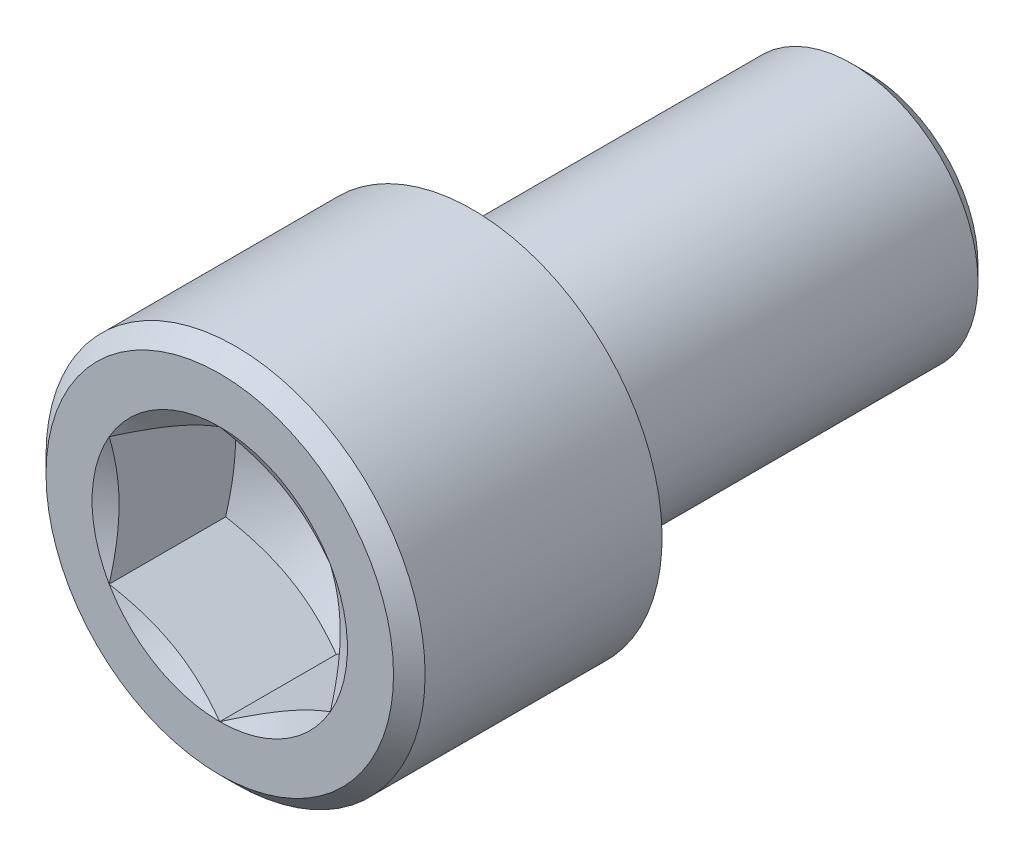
SolidWorks part; units mm, degrees
ref_plane "Front" through (0, 0, 0) normal (0, 0, 1) x (1, 0, 0)
ref_plane "Top" through (0, 0, 0) normal (0, 1, 0) x (1, 0, 0)
ref_plane "Right" through (0, 0, 0) normal (1, 0, 0) x (0, 0, -1)
sketch "Sketch1" plane through (0, 0, 0) normal (1, 0, 0) x (0, 0, -1)
  line L0 (0, 12) -> (-16, 12)
  line L1 (-16, 12) -> (-16, 0)
  line L2 (-16, 0) -> (25, 0)
  line L3 (25, 0) -> (25, 8)
  line L4 (25, 8) -> (0, 8)
  line L5 (0, 8) -> (0, 12)
  line L6 (0, 0) -> (12.7561, 0) construction
  dimension "l" = 25
  dimension "d" = 16
  dimension "k" = 16
  dimension "dk" = 24
revolve "Revolve1" add sketch "Sketch1" angle 360 about L2
sketch "Sketch7" plane through (0, 0, 0) normal (1, 0, 0) x (0, 0, -1)
  line L0 (-6.6396, 0) -> (3.6195, 0) construction
  line L1 (-16, 0) -> (-16, 7)
  line L2 (-16, 12) -> (-16, -12) construction
  line L3 (-16, 7) -> (-8, 7)
  line L4 (-8, 7) -> (-3.9585, 0)
  line L6 (-16, 0) -> (-3.9585, 0)
  dimension "D1" = 60
  dimension "S" = 14
  dimension "t" = 8
revolve "Cut-Revolve2" cut sketch "Sketch7" angle 360 about L6
chamfer "Chamfer1" distance 1 2 edges at (0, -8, -25) (0, -12, 16)
sketch "Sketch8" plane through (0, 0, 16) normal (0, 0, 1) x (1, 0, 0)
  line L1 (0, 8.0829) -> (-7, 4.0415)
  line L2 (-7, 4.0415) -> (-7, -4.0415)
  line L3 (-7, -4.0415) -> (0, -8.0829)
  line L4 (0, -8.0829) -> (7, -4.0415)
  line L5 (7, -4.0415) -> (7, 4.0415)
  line L6 (7, 4.0415) -> (0, 8.0829)
  circle A0 centre (0, 0) radius 7 construction
  circle A1 centre (0, 0) radius 7 construction
extrude "Cut-Extrude1" cut sketch "Sketch8" against normal up to surface (7.3748 mm away)
sketch "Sketch9" plane through (0, 0, 0) normal (1, 0, 0) x (0, 0, -1)
  line L0 (-16, 7) -> (4.2695, 7) construction
  line L3 (-16.5, 8.9489) -> (-16.5, 7)
  line L4 (-16.5, 7) -> (-15.3748, 7)
  line L5 (-15.3748, 7) -> (-16.5, 8.9489)
  line L6 (-16, 12) -> (-16, -12) construction
  dimension "D1" = 60
  dimension "D2" = 0.5
revolve "Cut-Revolve3" cut sketch "Sketch9" angle 360 about axis through (0, 0, 16) along (0, 0, -1)
fillet "Fillet2" radius 0.6 1 edges at (0, -8, 0)
